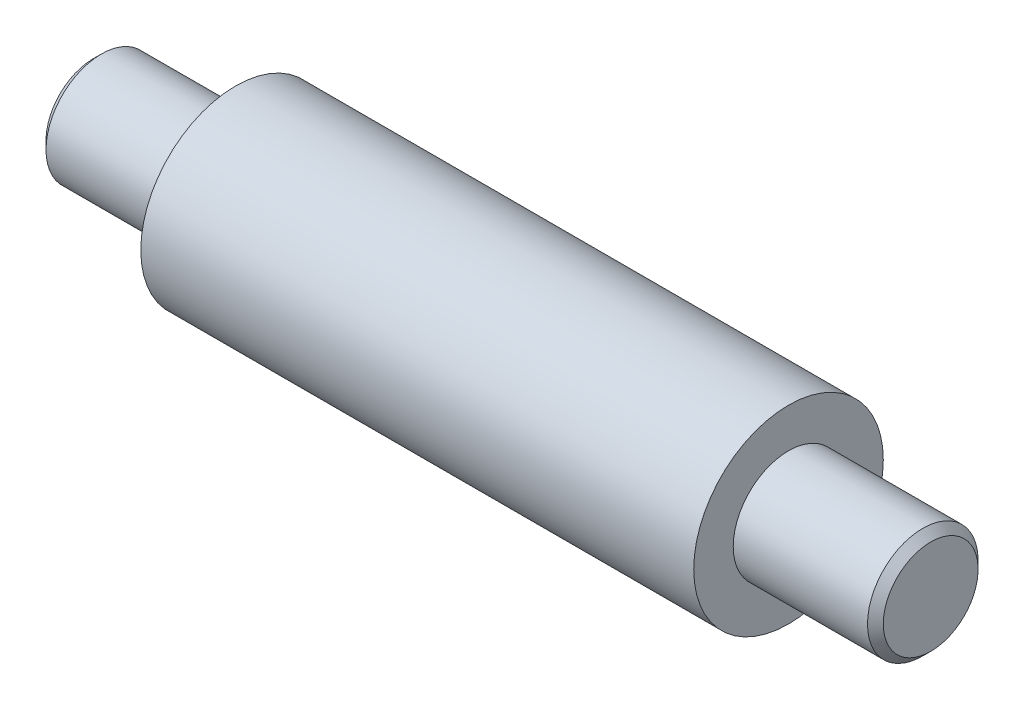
SolidWorks part; units mm, degrees
ref_plane "Front" through (0, 0, 0) normal (0, 0, 1) x (1, 0, 0)
ref_plane "Top" through (0, 0, 0) normal (0, 1, 0) x (1, 0, 0)
ref_plane "Right" through (0, 0, 0) normal (1, 0, 0) x (0, 0, -1)
sketch "Sketch1" plane through (0, 0, 0) normal (0, 0, 1) x (1, 0, 0)
  line L0 (0, 0) -> (106, 0)
  line L1 (106, 0) -> (106, 7)
  line L2 (106, 7) -> (88, 7)
  line L3 (88, 7) -> (88, 12)
  line L4 (88, 12) -> (18, 12)
  line L5 (18, 12) -> (18, 7)
  line L6 (18, 7) -> (0, 7)
  line L7 (0, 7) -> (0, 0)
  dimension "D1" = 7
  dimension "D2" = 18
  dimension "D3" = 18
  dimension "D4" = 70
  dimension "D5" = 12
  dimension "D6" = 7
revolve "Revolve1" add sketch "Sketch1" angle 360 about L0
chamfer "Chamfer1" distance 1 angle 45 2 edges at (106, 0, 7) (0, 0, 7)
